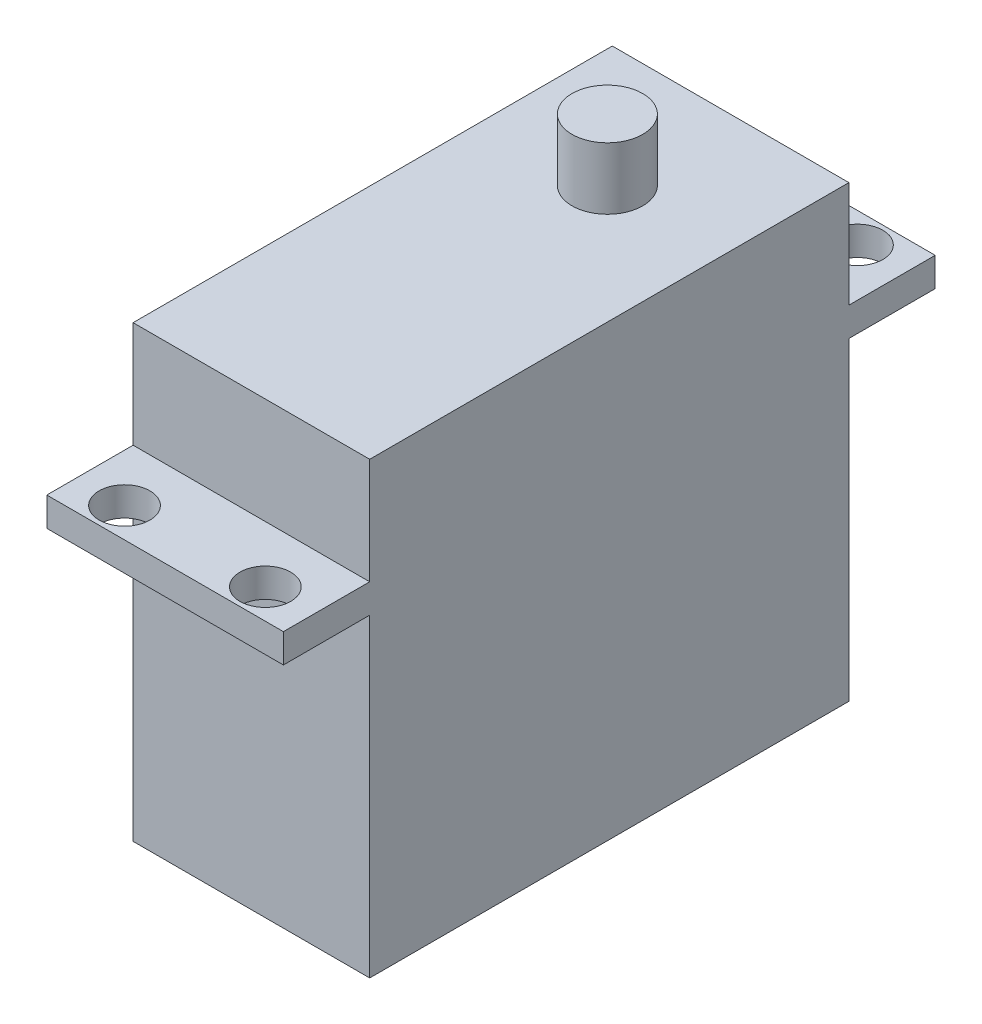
SolidWorks part; units mm, degrees
ref_plane "Front Plane" through (0, 0, 0) normal (0, 0, 1) x (1, 0, 0)
ref_plane "Top Plane" through (0, 0, 0) normal (0, 1, 0) x (1, 0, 0)
ref_plane "Right Plane" through (0, 0, 0) normal (1, 0, 0) x (0, 0, -1)
sketch "Sketch1" plane through (0, 0, 0) normal (0, 1, 0) x (1, 0, 0)
  line L0 (-10.033, 0) -> (10.033, 0) construction
  line L1 (-10.033, 20.32) -> (10.033, 20.32)
  line L2 (-10.033, 20.32) -> (-10.033, -20.32)
  line L3 (-10.033, -20.32) -> (10.033, -20.32)
  line L4 (10.033, 20.32) -> (10.033, -20.32)
  point P4 (-10.033, 0)
  point P5 (10.033, 0)
  dimension "D1" = 20.066
  dimension "D2" = 40.64
extrude "Extrude1" add sketch "Sketch1" along normal blind 38.1
sketch "Sketch3" plane through (0, 0, 20.32) normal (0, 0, 1) x (1, 0, 0)
  line L1 (-10.033, 29.1) -> (10.033, 29.1)
  line L2 (-10.033, 29.1) -> (-10.033, 26.65)
  line L3 (-10.033, 26.65) -> (10.033, 26.65)
  line L4 (10.033, 29.1) -> (10.033, 26.65)
  line L5 (10.033, 38.1) -> (10.033, 0) construction
  line L6 (-10.033, 38.1) -> (-10.033, 0) construction
  line L7 (-10.033, 0) -> (10.033, 0) construction
  dimension "D1" = 2.45
  dimension "D2" = 26.65
extrude "Extrude3" add sketch "Sketch3" along normal blind 7.32
mirror "Mirror1" about plane through (0, 0, 0) normal (0, 0, 1) of "Extrude3"
sketch "Sketch4" plane through (0, 38.1, 0) normal (0, 1, 0) x (1, 0, 0)
  line L0 (10.033, 20.32) -> (-10.033, 20.32) construction
  circle A0 centre (0, 9.87) radius 3
  dimension "D1" = 6
  dimension "D2" = 10.45
extrude "Extrude4" add sketch "Sketch4" along normal blind 5.25
hole_wizard "#18 (0.1695) Diameter Hole1" positions "3DSketch1" profile "Sketch5" hole size "#18" standard "Ansi Inch"
sketch3d "3DSketch1"
  line L0 (10.033, 29.1, 20.32) -> (-10.033, 29.1, 20.32) construction
  point P0 (5.9706, 29.1, 25.11)
  point P5 (10.7452, -8.5803, 0)
  dimension "D1" = 4.79
sketch "Sketch5" plane through (5.9706, 29.1, 25.11) normal (1, 0, 0) x (0, 0, 1)
  line L0 (0, 0) -> (0, 29.1)
  line L1 (0, 29.1) -> (2.1526, 29.1)
  line L2 (2.1526, 29.1) -> (2.1526, 0)
  line L5 (2.1526, 0) -> (0, 0)
  line L11 (0, -6.35) -> (0, 107.95) construction
  dimension "Thru Hole Dia." = 4.3053
  dimension "Thru Hole Depth" = 29.1
mirror "Mirror2" about plane through (0, 0, 0) normal (0, 0, 1) of "#18 (0.1695) Diameter Hole1"
mirror "Mirror3" about plane through (0, 0, 0) normal (1, 0, 0) of "Mirror2", "#18 (0.1695) Diameter Hole1"
